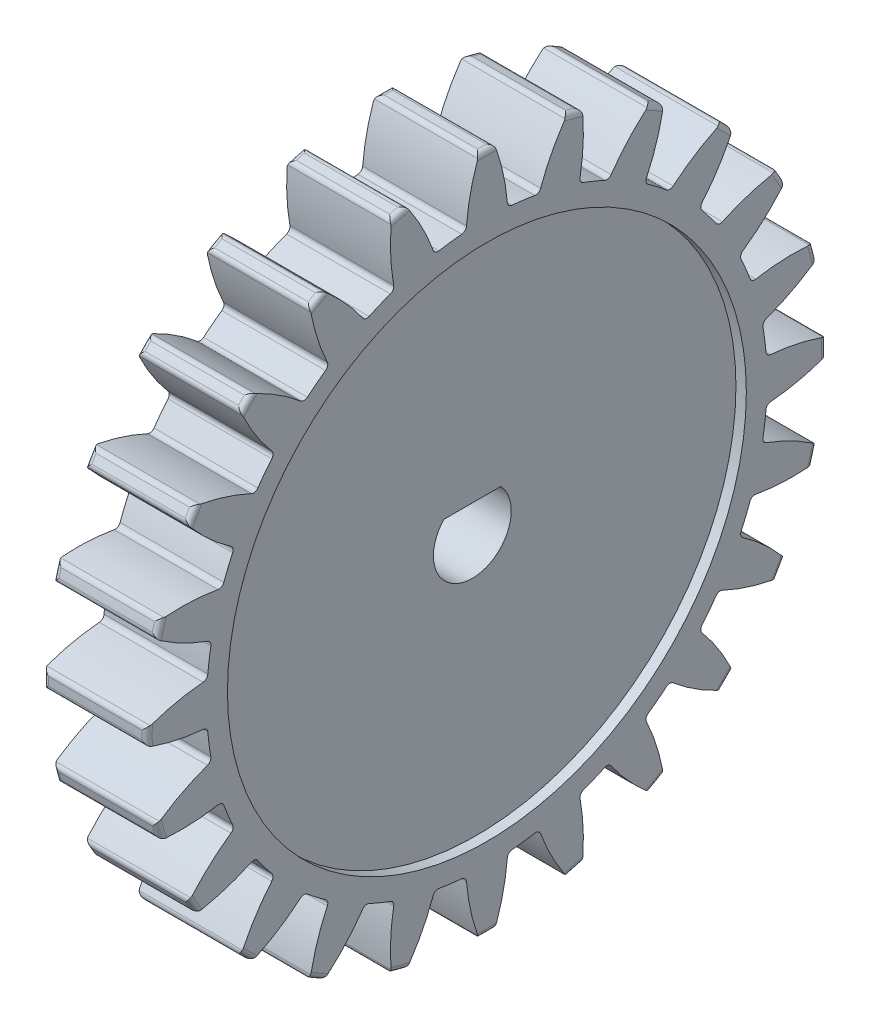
SolidWorks part; units mm, degrees
ref_plane "Alzado" through (0, 0, 0) normal (0, 0, 1) x (1, 0, 0)
ref_plane "Planta" through (0, 0, 0) normal (0, 1, 0) x (1, 0, 0)
ref_plane "Vista lateral" through (0, 0, 0) normal (1, 0, 0) x (0, 0, -1)
sketch "Plan" plane through (0, 0, 0) normal (1, 0, 0) x (0, 0, -1)
  line L1 (4, -4) -> (-4, -4) construction
  line L2 (4, -4) -> (4, 4) construction
  line L3 (4, 4) -> (-4, 4) construction
  line L4 (-4, -4) -> (-4, 4) construction
  line L5 (4, -4) -> (-4, 4) construction
  line L6 (4, 4) -> (-4, -4) construction
  circle A0 centre (-4, 4) radius 2.4
  circle A1 centre (4, 4) radius 2.4
  circle A2 centre (4, -4) radius 2.4
  circle A3 centre (-4, -4) radius 2.4
  point P9 (0, 0)
  dimension "D1" = 4.8
  dimension "D2" = 8
sketch "Croquis1" plane through (0, 0, 0) normal (1, 0, 0) x (0, 0, -1)
  line L0 (2.2768, -0.7589) -> (-2.2768, 0.7589) construction
  circle A1 centre (0, 0) radius 10.8
  dimension "D1" = 21.6
extrude "Body" add sketch "Croquis1" along normal mid plane 4
sketch "Croquis2" plane through (0, 0, 0) normal (1, 0, 0) x (0, 0, -1)
  circle A0 centre (0, 0) radius 10
  dimension "D1" = 20
extrude "Cortar-Extruir1" cut sketch "Croquis2" along normal blind 0.8 from offset 1.6
mirror "Simetría1" about plane through (0, 0, 0) normal (1, 0, 0) of "Cortar-Extruir1"
sketch "Croquis7" plane through (0, 0, 0) normal (1, 0, 0) x (0, 0, -1)
  line L1 (0, 0) -> (0, 13.1) construction
  arc A0 (0.3, 13.0966) -> (-0.3, 13.0966) centre (0, 0) ccw
  circle A1 centre (0, 0) radius 10.8 construction
  arc A2 (0.8, 10.7703) -> (-0.8, 10.7703) centre (0, 0) ccw
  arc A3 (-0.8, 10.7703) -> (-0.3, 13.0966) centre (7.1844, 10.271) cw
  arc A4 (0.8, 10.7703) -> (0.3, 13.0966) centre (-7.1844, 10.271) ccw
  circle A5 centre (0, 0) radius 13.1 construction
  dimension "D1" = 0.6
  dimension "D3" = 8
  dimension "D5" = 26.2
  dimension "D2" = 1.6
extrude "Tooth" add sketch "Croquis7" along normal mid plane 4
fillet "Redondeo1" radius 0.2 6 edges at (0, 13.0966, -0.3) (2, 13.1, 0) (0, 13.0966, 0.3) (-2, 13.1, 0) (0, 10.7703, -0.8) (0, 10.7703, 0.8)
pattern_circular "MatrizC1 Teeth" count 24 over 360 about axis through (0, 0, 0) along (1, 0, 0) of "Tooth", "Redondeo1"
sketch "Sketch2" plane through (1.6, 0, 0) normal (1, 0, 0) x (0, 0, -1)
  line L0 (-0.1794, -1.3361) -> (-0.1794, -1.334)
  line L1 (-1.2645, 1.1829) -> (0.9395, 1.1842)
  arc A0 (-1.2645, 1.1829) -> (0.9395, 1.1842) centre (-0.1619, 0.1659) ccw
  dimension "D1" = 3
extrude "Cut-Extrude7" cut sketch "Sketch2" against normal blind 10 contours A0 L1
